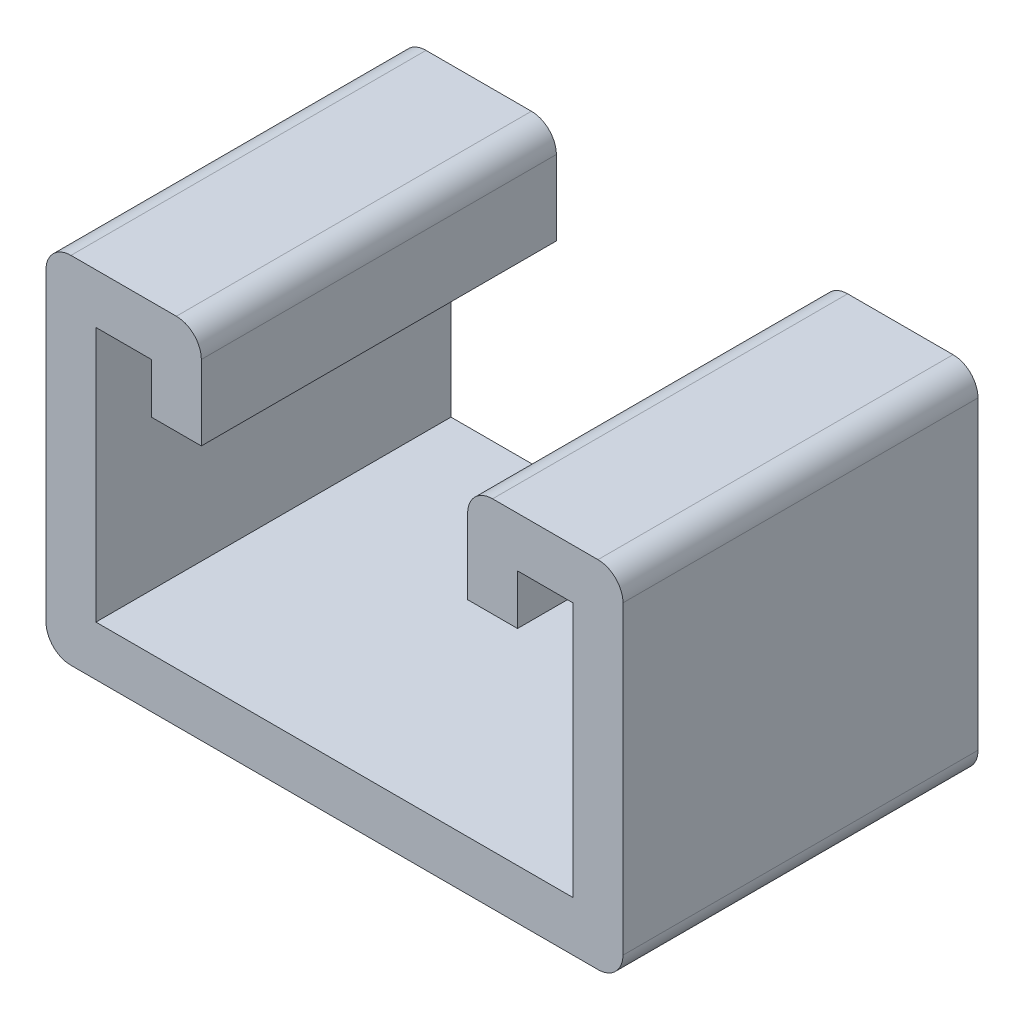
SolidWorks part; units mm, degrees
ref_plane "Plane1" through (0, 0, 0) normal (0, 0, 1) x (1, 0, 0)
ref_plane "Plane2" through (0, 0, 0) normal (0, 1, 0) x (1, 0, 0)
ref_plane "Plane3" through (0, 0, 0) normal (1, 0, 0) x (0, 0, -1)
sketch "Sketch1" plane through (0, 0, 0) normal (0, 0, 1) x (1, 0, 0)
  line L0 (-11.3109, 12.7) -> (-18.8516, 12.7)
  line L1 (-20.6375, 10.9141) -> (-20.6375, -10.9141)
  line L2 (-18.8516, -12.7) -> (18.8516, -12.7)
  line L3 (20.6375, -10.9141) -> (20.6375, 10.9141)
  line L4 (18.8516, 12.7) -> (11.3109, 12.7)
  line L5 (9.525, 10.9141) -> (9.525, 5.5563)
  line L6 (-9.525, 10.9141) -> (-9.525, 5.5563)
  line L7 (-13.0969, 9.1281) -> (-13.0969, 5.5563)
  line L8 (-13.0969, 9.1281) -> (-17.0656, 9.1281)
  line L9 (-17.0656, 9.1281) -> (-17.0656, -9.1281)
  line L10 (-17.0656, -9.1281) -> (17.0656, -9.1281)
  line L11 (17.0656, -9.1281) -> (17.0656, 9.1281)
  line L12 (17.0656, 9.1281) -> (13.0969, 9.1281)
  line L13 (13.0969, 9.1281) -> (13.0969, 5.5563)
  line L14 (-13.0969, 5.5563) -> (-9.525, 5.5563)
  line L15 (9.525, 5.5563) -> (13.0969, 5.5563)
  arc A0 (-11.3109, 12.7) -> (-9.525, 10.9141) centre (-11.3109, 10.9141) cw
  arc A1 (-20.6375, 10.9141) -> (-18.8516, 12.7) centre (-18.8516, 10.9141) cw
  arc A2 (-18.8516, -12.7) -> (-20.6375, -10.9141) centre (-18.8516, -10.9141) cw
  arc A3 (20.6375, -10.9141) -> (18.8516, -12.7) centre (18.8516, -10.9141) cw
  arc A4 (18.8516, 12.7) -> (20.6375, 10.9141) centre (18.8516, 10.9141) cw
  arc A5 (9.525, 10.9141) -> (11.3109, 12.7) centre (11.3109, 10.9141) cw
  dimension "D2" = 1.7859
  dimension "D3" = 20.6375
  dimension "Width" = 41.275
  dimension "D5" = 12.7
  dimension "Height" = 25.4
  dimension "edge" = 11.1125
  dimension "D8" = 19.05
  dimension "ToeHt" = 7.1437
  dimension "gauge" = 3.5719
extrude "Base-Extrude" add sketch "Sketch1" along normal mid plane 25.4
equation "\"D5@Sketch1\" = \"Height@Sketch1\" / 2"
equation "\"D3@Sketch1\" = \"Width@Sketch1\" / 2"
equation "\"D2@Sketch1\" = \"gauge@Sketch1\" / 2"
equation "\"D8@Sketch1\" = \"Width@Sketch1\" - 2 * \"edge@Sketch1\""
equation "\"gauge@Sketch1\" = \"ToeHt@Sketch1\" / 2"
